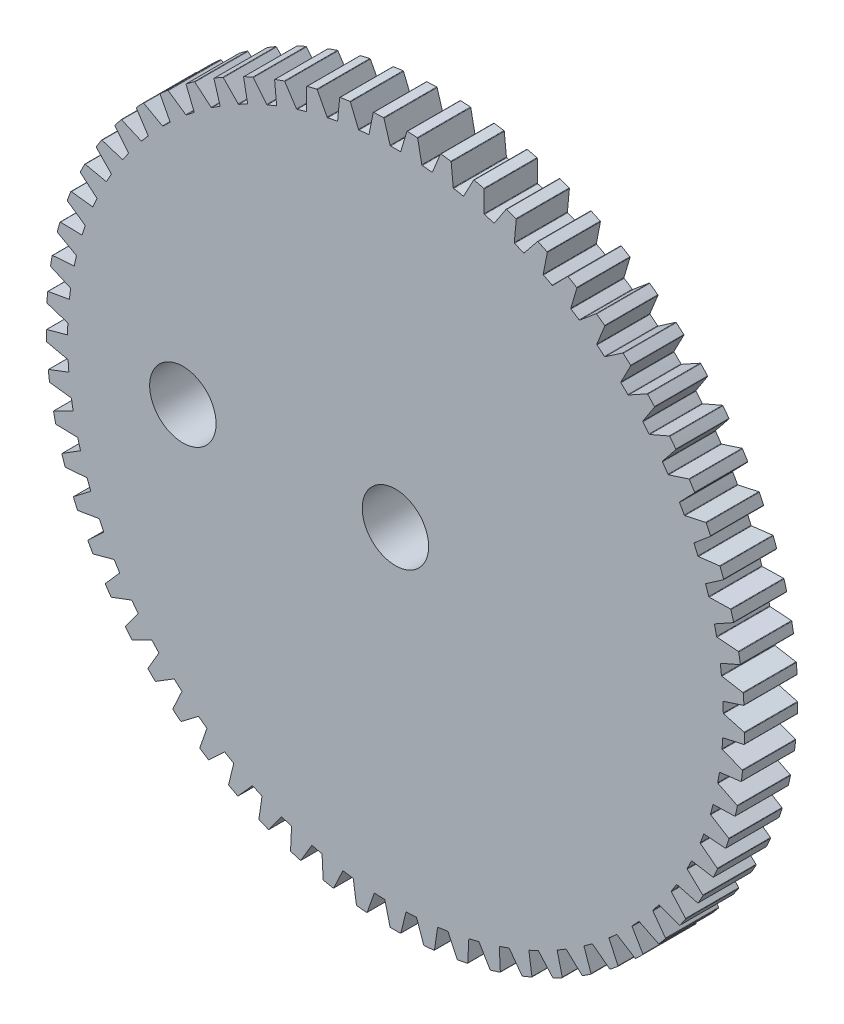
SolidWorks part; units mm, degrees
ref_plane "Front Plane" through (0, 0, 0) normal (0, 0, 1) x (1, 0, 0)
ref_plane "Top Plane" through (0, 0, 0) normal (0, 1, 0) x (1, 0, 0)
ref_plane "Right Plane" through (0, 0, 0) normal (1, 0, 0) x (0, 0, -1)
sketch "Sketch1" plane through (0, 0, 0) normal (0, 0, 1) x (1, 0, 0)
  line L0 (-2.3622, 38.1) -> (-2.3622, -38.1) construction
  circle A0 centre (-19.05, -3.81) radius 16.6878
  dimension "D1" = 33.3756
extrude "Extrude1" add sketch "Sketch1" along normal blind 2.54
sketch "Sketch3" plane through (0, 0, 2.54) normal (0, 0, 1) x (1, 0, 0)
  line L0 (-19.05, -19.4818) -> (-19.05, -20.4978) construction
  line L1 (-19.304, -19.4797) -> (-19.304, -20.4959) construction
  line L2 (-18.796, -19.4797) -> (-18.796, -20.4959) construction
  line L3 (-19.558, -19.4736) -> (-19.558, -20.4978) construction
  line L4 (-18.542, -19.4736) -> (-18.542, -20.4978) construction
  line L9 (-18.7913, -20.4769) -> (-18.5466, -19.4922)
  line L10 (-19.3087, -20.4769) -> (-19.5534, -19.4922)
  line L11 (-15.6135, -19.1004) -> (-22.4865, -19.1004) construction
  line L12 (-20.4011, -20.424) -> (-20.0625, -19.4676)
  line L13 (-20.9161, -20.3741) -> (-21.0646, -19.3704)
  line L14 (-21.9983, -20.2161) -> (-21.569, -19.2967)
  line L15 (-22.5061, -20.1167) -> (-22.557, -19.1033)
  line L16 (-23.5679, -19.8549) -> (-23.0519, -18.9813)
  line L17 (-24.0637, -19.707) -> (-24.0166, -18.6935)
  line L18 (-25.0954, -19.344) -> (-24.4975, -18.5243)
  line L19 (-25.5746, -19.1489) -> (-25.4299, -18.1446)
  line L20 (-26.5664, -18.688) -> (-25.8922, -17.9298)
  line L21 (-27.0246, -18.4476) -> (-26.7836, -17.462)
  line L22 (-27.9672, -17.8931) -> (-27.223, -17.2035)
  line L23 (-28.4001, -17.6096) -> (-28.0651, -16.6518)
  line L24 (-29.2848, -16.9667) -> (-28.4775, -16.3522)
  line L25 (-29.6883, -16.6427) -> (-29.2624, -15.7218)
  line L26 (-30.5069, -15.9175) -> (-29.644, -15.3838)
  line L27 (-30.8771, -15.5561) -> (-30.3644, -14.6805)
  line L28 (-31.6219, -14.7552) -> (-30.7116, -14.3073)
  line L29 (-31.9556, -14.3598) -> (-31.3607, -13.5378)
  line L30 (-32.6196, -13.4908) -> (-31.6702, -13.1328)
  line L31 (-32.9135, -13.0649) -> (-32.2421, -12.3042)
  line L32 (-33.4906, -12.1359) -> (-32.5111, -11.8712)
  line L33 (-33.7421, -11.6837) -> (-33.0004, -10.9914)
  line L34 (-34.2267, -10.7034) -> (-33.2263, -10.5344)
  line L35 (-34.4334, -10.229) -> (-33.6283, -9.6114)
  line L36 (-34.8212, -9.2064) -> (-33.8091, -9.1348)
  line L37 (-34.9811, -8.7143) -> (-34.1202, -8.1773)
  line L38 (-35.2684, -7.6591) -> (-34.2541, -7.6855)
  line L39 (-35.3801, -7.1538) -> (-34.4714, -6.7025)
  line L40 (-35.5642, -6.0758) -> (-34.5572, -6.2)
  line L41 (-35.6265, -5.5621) -> (-34.6785, -5.2006)
  line L42 (-35.7058, -4.4714) -> (-34.7154, -4.6922)
  line L43 (-35.7183, -3.9541) -> (-34.7398, -3.6857)
  line L44 (-35.6918, -2.8608) -> (-34.7275, -3.1761)
  line L45 (-35.6544, -2.3447) -> (-34.6545, -2.172)
  line L46 (-35.5225, -1.259) -> (-34.5931, -1.666)
  line L47 (-35.4354, -0.749) -> (-34.4236, -0.6736)
  line L48 (-35.1994, 0.3189) -> (-34.3136, -0.1759)
  line L49 (-35.0635, 0.8181) -> (-34.0491, 0.7955)
  line L50 (-34.7255, 1.8583) -> (-33.8916, 1.2803)
  line L51 (-34.5421, 2.3421) -> (-33.5346, 2.2216)
  line L52 (-34.1053, 3.3447) -> (-33.331, 2.689)
  line L53 (-33.876, 3.8085) -> (-32.8848, 3.5915)
  line L54 (-33.3445, 4.7643) -> (-32.6371, 4.037)
  line L55 (-33.0715, 5.2039) -> (-32.1059, 4.8922)
  line L56 (-32.4502, 6.1039) -> (-31.8163, 5.3117)
  line L57 (-32.136, 6.5151) -> (-31.2051, 6.1116)
  line L58 (-31.4308, 7.351) -> (-30.8764, 6.5012)
  line L59 (-31.0784, 7.7299) -> (-30.1908, 7.2384)
  line L60 (-30.2958, 8.4938) -> (-29.826, 7.5945)
  line L61 (-29.9085, 8.8369) -> (-29.0724, 8.2621)
  line L62 (-29.0559, 9.5217) -> (-28.675, 8.5813)
  line L63 (-28.6372, 9.8259) -> (-27.8605, 9.173)
  line L64 (-27.7224, 10.4252) -> (-27.4341, 9.4524)
  line L65 (-27.2764, 10.6875) -> (-26.5664, 9.9628)
  line L66 (-26.3081, 11.1957) -> (-26.115, 10.1997)
  line L67 (-25.8388, 11.4138) -> (-25.202, 10.6239)
  line L68 (-24.8259, 11.8262) -> (-24.7299, 10.8161)
  line L69 (-24.3378, 11.9979) -> (-23.7802, 11.1503)
  line L70 (-23.2898, 12.3107) -> (-23.2917, 11.296)
  line L71 (-22.7874, 12.4345) -> (-22.3142, 11.537)
  line L72 (-21.7142, 12.6446) -> (-21.814, 11.6349)
  line L73 (-21.2022, 12.7194) -> (-20.8178, 11.7804)
  line L74 (-20.1136, 12.8249) -> (-20.3104, 11.8296)
  line L75 (-19.5968, 12.8499) -> (-19.3049, 11.8782)
  line L76 (-18.5032, 12.8499) -> (-18.7951, 11.8782)
  line L77 (-17.9864, 12.8249) -> (-17.7896, 11.8296)
  line L78 (-16.8978, 12.7194) -> (-17.2822, 11.7804)
  line L79 (-16.3858, 12.6446) -> (-16.286, 11.6349)
  line L80 (-15.3126, 12.4345) -> (-15.7858, 11.537)
  line L81 (-14.8102, 12.3107) -> (-14.8083, 11.296)
  line L82 (-13.7622, 11.9979) -> (-14.3198, 11.1503)
  line L83 (-13.2741, 11.8262) -> (-13.3701, 10.8161)
  line L84 (-12.2612, 11.4138) -> (-12.898, 10.6239)
  line L85 (-11.7919, 11.1957) -> (-11.985, 10.1997)
  line L86 (-10.8236, 10.6875) -> (-11.5336, 9.9628)
  line L87 (-10.3776, 10.4252) -> (-10.6659, 9.4524)
  line L88 (-9.4628, 9.8259) -> (-10.2395, 9.173)
  line L89 (-9.0441, 9.5217) -> (-9.425, 8.5813)
  line L90 (-8.1915, 8.8369) -> (-9.0276, 8.2621)
  line L91 (-7.8042, 8.4938) -> (-8.274, 7.5945)
  line L92 (-7.0216, 7.7299) -> (-7.9092, 7.2384)
  line L93 (-6.6692, 7.351) -> (-7.2236, 6.5012)
  line L94 (-5.964, 6.5151) -> (-6.8949, 6.1116)
  line L95 (-5.6498, 6.1039) -> (-6.2837, 5.3117)
  line L96 (-5.0285, 5.2039) -> (-5.9941, 4.8922)
  line L97 (-4.7555, 4.7643) -> (-5.4629, 4.037)
  line L98 (-4.224, 3.8085) -> (-5.2152, 3.5915)
  line L99 (-3.9947, 3.3447) -> (-4.769, 2.689)
  line L100 (-3.5579, 2.3421) -> (-4.5654, 2.2216)
  line L101 (-3.3745, 1.8583) -> (-4.2084, 1.2803)
  line L102 (-3.0365, 0.8181) -> (-4.0509, 0.7955)
  line L103 (-2.9006, 0.3189) -> (-3.7864, -0.1759)
  line L104 (-2.6646, -0.749) -> (-3.6764, -0.6736)
  line L105 (-2.5775, -1.259) -> (-3.5069, -1.666)
  line L106 (-2.4456, -2.3447) -> (-3.4455, -2.172)
  line L107 (-2.4082, -2.8608) -> (-3.3725, -3.1761)
  line L108 (-2.3817, -3.9541) -> (-3.3602, -3.6857)
  line L109 (-2.3942, -4.4714) -> (-3.3846, -4.6922)
  line L110 (-2.4735, -5.5621) -> (-3.4215, -5.2006)
  line L111 (-2.5358, -6.0758) -> (-3.5428, -6.2)
  line L112 (-2.7199, -7.1538) -> (-3.6286, -6.7025)
  line L113 (-2.8316, -7.6591) -> (-3.8459, -7.6855)
  line L114 (-3.1189, -8.7143) -> (-3.9798, -8.1773)
  line L115 (-3.2788, -9.2064) -> (-4.2909, -9.1348)
  line L116 (-3.6666, -10.229) -> (-4.4717, -9.6114)
  line L117 (-3.8733, -10.7034) -> (-4.8737, -10.5344)
  line L118 (-4.3579, -11.6837) -> (-5.0996, -10.9914)
  line L119 (-4.6094, -12.1359) -> (-5.5889, -11.8712)
  line L120 (-5.1865, -13.0649) -> (-5.8579, -12.3042)
  line L121 (-5.4804, -13.4908) -> (-6.4298, -13.1328)
  line L122 (-6.1444, -14.3598) -> (-6.7393, -13.5378)
  line L123 (-6.4781, -14.7552) -> (-7.3884, -14.3073)
  line L124 (-7.2229, -15.5561) -> (-7.7356, -14.6805)
  line L125 (-7.5931, -15.9175) -> (-8.456, -15.3838)
  line L126 (-8.4117, -16.6427) -> (-8.8376, -15.7218)
  line L127 (-8.8152, -16.9667) -> (-9.6225, -16.3522)
  line L128 (-9.6999, -17.6096) -> (-10.0349, -16.6518)
  line L129 (-10.1328, -17.8931) -> (-10.877, -17.2035)
  line L130 (-11.0754, -18.4476) -> (-11.3164, -17.462)
  line L131 (-11.5336, -18.688) -> (-12.2078, -17.9298)
  line L132 (-12.5254, -19.1489) -> (-12.6701, -18.1446)
  line L133 (-13.0046, -19.344) -> (-13.6025, -18.5243)
  line L134 (-14.0363, -19.707) -> (-14.0834, -18.6935)
  line L135 (-14.5321, -19.8549) -> (-15.0481, -18.9813)
  line L136 (-15.5939, -20.1167) -> (-15.543, -19.1033)
  line L137 (-16.1017, -20.2161) -> (-16.531, -19.2967)
  line L138 (-17.1839, -20.3741) -> (-17.0354, -19.3704)
  line L139 (-17.6989, -20.424) -> (-18.0375, -19.4676)
  arc A0 (-19.2844, -20.4962) -> (-18.8156, -20.4962) centre (-19.05, -3.81) ccw
  arc A1 (-20.037, -19.4507) -> (-20.0625, -19.4676) centre (-20.0386, -19.476) ccw
  arc A2 (-19.3087, -20.4769) -> (-19.2844, -20.4962) centre (-19.2841, -20.4708) ccw
  arc A3 (-18.7913, -20.4769) -> (-18.8156, -20.4962) centre (-18.8159, -20.4708) cw
  arc A4 (-20.4011, -20.424) -> (-20.4271, -20.4409) centre (-20.425, -20.4156) cw
  arc A5 (-18.5228, -19.4729) -> (-18.5466, -19.4922) centre (-18.522, -19.4983) ccw
  arc A6 (-19.5772, -19.4729) -> (-19.5534, -19.4922) centre (-19.578, -19.4983) cw
  arc A7 (-20.8938, -20.3956) -> (-20.4271, -20.4409) centre (-19.05, -3.81) ccw
  arc A8 (-20.9161, -20.3741) -> (-20.8938, -20.3956) centre (-20.891, -20.3704) ccw
  arc A9 (-21.5423, -19.2823) -> (-21.0864, -19.3489) centre (-19.05, -3.81) ccw
  arc A10 (-21.0864, -19.3489) -> (-21.0646, -19.3704) centre (-21.0897, -19.3741) cw
  arc A11 (-21.5419, -19.2824) -> (-21.569, -19.2967) centre (-21.546, -19.3075) ccw
  arc A12 (-20.0374, -19.4507) -> (-19.5772, -19.4729) centre (-19.05, -3.81) ccw
  arc A13 (-21.9983, -20.2161) -> (-22.0258, -20.2303) centre (-22.0213, -20.2053) cw
  arc A14 (-22.4859, -20.1403) -> (-22.0258, -20.2303) centre (-19.05, -3.81) ccw
  arc A15 (-22.5061, -20.1167) -> (-22.4859, -20.1403) centre (-22.4807, -20.1154) ccw
  arc A16 (-23.024, -18.9696) -> (-22.5766, -19.0798) centre (-19.05, -3.81) ccw
  arc A17 (-22.5766, -19.0798) -> (-22.557, -19.1033) centre (-22.5823, -19.1046) cw
  arc A18 (-23.0236, -18.9697) -> (-23.0519, -18.9813) centre (-23.03, -18.9942) ccw
  arc A19 (-23.5679, -19.8549) -> (-23.5967, -19.8665) centre (-23.5898, -19.842) cw
  arc A20 (-24.046, -19.7324) -> (-23.5967, -19.8665) centre (-19.05, -3.81) ccw
  arc A21 (-24.0637, -19.707) -> (-24.046, -19.7324) centre (-24.0384, -19.7082) ccw
  arc A22 (-24.4686, -18.5153) -> (-24.0339, -18.6682) centre (-19.05, -3.81) ccw
  arc A23 (-24.0339, -18.6682) -> (-24.0166, -18.6935) centre (-24.042, -18.6923) cw
  arc A24 (-24.4682, -18.5154) -> (-24.4975, -18.5243) centre (-24.4769, -18.5392) ccw
  arc A25 (-25.0954, -19.344) -> (-25.1251, -19.3527) centre (-25.1159, -19.329) cw
  arc A26 (-25.5594, -19.1759) -> (-25.1251, -19.3527) centre (-19.05, -3.81) ccw
  arc A27 (-25.5746, -19.1489) -> (-25.5594, -19.1759) centre (-25.5495, -19.1525) ccw
  arc A28 (-25.8625, -17.9236) -> (-25.4447, -18.1178) centre (-19.05, -3.81) ccw
  arc A29 (-25.4447, -18.1178) -> (-25.4299, -18.1446) centre (-25.455, -18.141) cw
  arc A30 (-25.8621, -17.9238) -> (-25.8922, -17.9298) centre (-25.8732, -17.9467) ccw
  arc A31 (-26.5664, -18.688) -> (-26.5969, -18.6938) centre (-26.5854, -18.6711) cw
  arc A32 (-27.012, -18.4759) -> (-26.5969, -18.6938) centre (-19.05, -3.81) ccw
  arc A33 (-27.0246, -18.4476) -> (-27.012, -18.4759) centre (-26.9999, -18.4536) ccw
  arc A34 (-27.1929, -17.2003) -> (-26.7957, -17.4338) centre (-19.05, -3.81) ccw
  arc A35 (-26.7957, -17.4338) -> (-26.7836, -17.462) centre (-26.8083, -17.4559) cw
  arc A36 (-27.1925, -17.2005) -> (-27.223, -17.2035) centre (-27.2057, -17.2222) ccw
  arc A37 (-27.9672, -17.8931) -> (-27.9981, -17.8959) centre (-27.9845, -17.8745) cw
  arc A38 (-28.3903, -17.639) -> (-27.9981, -17.8959) centre (-19.05, -3.81) ccw
  arc A39 (-28.4001, -17.6096) -> (-28.3903, -17.639) centre (-28.3761, -17.618) ccw
  arc A40 (-28.4472, -16.3518) -> (-28.0744, -16.6227) centre (-19.05, -3.81) ccw
  arc A41 (-28.0744, -16.6227) -> (-28.0651, -16.6518) centre (-28.0891, -16.6434) cw
  arc A42 (-28.4469, -16.3521) -> (-28.4775, -16.3522) centre (-28.4621, -16.3724) ccw
  arc A43 (-29.2848, -16.9667) -> (-29.3158, -16.9666) centre (-29.3002, -16.9465) cw
  arc A44 (-29.6814, -16.673) -> (-29.3158, -16.9666) centre (-19.05, -3.81) ccw
  arc A45 (-29.6883, -16.6427) -> (-29.6814, -16.673) centre (-29.6652, -16.6534) ccw
  arc A46 (-29.6138, -15.3863) -> (-29.2689, -15.6919) centre (-19.05, -3.81) ccw
  arc A47 (-29.2689, -15.6919) -> (-29.2624, -15.7218) centre (-29.2855, -15.7111) cw
  arc A48 (-29.6135, -15.3866) -> (-29.644, -15.3838) centre (-29.6306, -15.4054) ccw
  arc A49 (-30.5069, -15.9175) -> (-30.5377, -15.9143) centre (-30.5202, -15.8959) cw
  arc A50 (-30.8732, -15.5868) -> (-30.5377, -15.9143) centre (-19.05, -3.81) ccw
  arc A51 (-30.8771, -15.5561) -> (-30.8732, -15.5868) centre (-30.8552, -15.5689) ccw
  arc A52 (-30.6818, -14.3127) -> (-30.368, -14.6501) centre (-19.05, -3.81) ccw
  arc A53 (-30.368, -14.6501) -> (-30.3644, -14.6805) centre (-30.3863, -14.6677) cw
  arc A54 (-30.6815, -14.313) -> (-30.7116, -14.3073) centre (-30.7003, -14.3301) ccw
  arc A55 (-31.6219, -14.7552) -> (-31.6523, -14.7491) centre (-31.6331, -14.7325) cw
  arc A56 (-31.9547, -14.3908) -> (-31.6523, -14.7491) centre (-19.05, -3.81) ccw
  arc A57 (-31.9556, -14.3598) -> (-31.9547, -14.3908) centre (-31.935, -14.3747) ccw
  arc A58 (-31.6411, -13.1411) -> (-31.3614, -13.5072) centre (-19.05, -3.81) ccw
  arc A59 (-31.3614, -13.5072) -> (-31.3607, -13.5378) centre (-31.3813, -13.5229) cw
  arc A60 (-31.6409, -13.1414) -> (-31.6702, -13.1328) centre (-31.6613, -13.1565) ccw
  arc A61 (-32.6196, -13.4908) -> (-32.6493, -13.4817) centre (-32.6286, -13.467) cw
  arc A62 (-32.9156, -13.0959) -> (-32.6493, -13.4817) centre (-19.05, -3.81) ccw
  arc A63 (-32.9135, -13.0649) -> (-32.9156, -13.0959) centre (-32.8945, -13.0818) ccw
  arc A64 (-32.4829, -11.8823) -> (-32.2398, -12.2737) centre (-19.05, -3.81) ccw
  arc A65 (-32.2398, -12.2737) -> (-32.2421, -12.3042) centre (-32.2612, -12.2874) cw
  arc A66 (-32.4827, -11.8827) -> (-32.5111, -11.8712) centre (-32.5045, -11.8957) ccw
  arc A67 (-33.4906, -12.1359) -> (-33.5192, -12.1241) centre (-33.4972, -12.1114) cw
  arc A68 (-33.7471, -11.7143) -> (-33.5192, -12.1241) centre (-19.05, -3.81) ccw
  arc A69 (-33.7421, -11.6837) -> (-33.7471, -11.7143) centre (-33.7247, -11.7023) ccw
  arc A70 (-33.1993, -10.5481) -> (-32.9951, -10.9612) centre (-19.05, -3.81) ccw
  arc A71 (-32.9951, -10.9612) -> (-33.0004, -10.9914) centre (-33.0177, -10.9728) cw
  arc A72 (-33.1991, -10.5485) -> (-33.2263, -10.5344) centre (-33.2221, -10.5594) ccw
  arc A73 (-34.2267, -10.7034) -> (-34.2541, -10.6888) centre (-34.231, -10.6783) cw
  arc A74 (-34.4414, -10.2589) -> (-34.2541, -10.6888) centre (-19.05, -3.81) ccw
  arc A75 (-34.4334, -10.229) -> (-34.4414, -10.2589) centre (-34.4179, -10.2491) ccw
  arc A76 (-33.7836, -9.1511) -> (-33.6202, -9.5819) centre (-19.05, -3.81) ccw
  arc A77 (-33.6202, -9.5819) -> (-33.6283, -9.6114) centre (-33.6438, -9.5913) cw
  arc A78 (-33.7834, -9.1515) -> (-33.8091, -9.1348) centre (-33.8073, -9.1601) ccw
  arc A79 (-34.8212, -9.2064) -> (-34.847, -9.1893) centre (-34.823, -9.1811) cw
  arc A80 (-34.9919, -8.7434) -> (-34.847, -9.1893) centre (-19.05, -3.81) ccw
  arc A81 (-34.9811, -8.7143) -> (-34.9919, -8.7434) centre (-34.9677, -8.7358) ccw
  arc A82 (-34.2303, -7.7042) -> (-34.1092, -8.1487) centre (-19.05, -3.81) ccw
  arc A83 (-34.1092, -8.1487) -> (-34.1202, -8.1773) centre (-34.1336, -8.1558) cw
  arc A84 (-34.2302, -7.7046) -> (-34.2541, -7.6855) centre (-34.2548, -7.7109) ccw
  arc A85 (-35.2684, -7.6591) -> (-35.2925, -7.6395) centre (-35.2677, -7.6337) cw
  arc A86 (-35.3936, -7.1817) -> (-35.2925, -7.6395) centre (-19.05, -3.81) ccw
  arc A87 (-35.3801, -7.1538) -> (-35.3936, -7.1817) centre (-35.3688, -7.1766) ccw
  arc A88 (-34.5353, -6.2209) -> (-34.4577, -6.6751) centre (-19.05, -3.81) ccw
  arc A89 (-34.4577, -6.6751) -> (-34.4714, -6.7025) centre (-34.4827, -6.6797) cw
  arc A90 (-34.5352, -6.2213) -> (-34.5572, -6.2) centre (-34.5603, -6.2252) ccw
  arc A91 (-35.5642, -6.0758) -> (-35.5862, -6.054) centre (-35.5611, -6.0506) cw
  arc A92 (-35.6427, -5.5886) -> (-35.5862, -6.054) centre (-19.05, -3.81) ccw
  arc A93 (-35.6265, -5.5621) -> (-35.6427, -5.5886) centre (-35.6175, -5.5859) ccw
  arc A94 (-34.6956, -4.7151) -> (-34.6623, -5.1746) centre (-19.05, -3.81) ccw
  arc A95 (-34.6623, -5.1746) -> (-34.6785, -5.2006) centre (-34.6876, -5.1768) cw
  arc A96 (-34.6956, -4.7155) -> (-34.7154, -4.6922) centre (-34.721, -4.717) ccw
  arc A97 (-35.7058, -4.4714) -> (-35.7256, -4.4476) centre (-35.7002, -4.4466) cw
  arc A98 (-35.7369, -3.9788) -> (-35.7256, -4.4476) centre (-19.05, -3.81) ccw
  arc A99 (-35.7183, -3.9541) -> (-35.7369, -3.9788) centre (-35.7115, -3.9786) ccw
  arc A100 (-34.71, -3.2008) -> (-34.7211, -3.6615) centre (-19.05, -3.81) ccw
  arc A101 (-34.7211, -3.6615) -> (-34.7398, -3.6857) centre (-34.7465, -3.6612) cw
  arc A102 (-34.71, -3.2012) -> (-34.7275, -3.1761) centre (-34.7354, -3.2003) ccw
  arc A103 (-35.6918, -2.8608) -> (-35.7093, -2.8351) centre (-35.6839, -2.8366) cw
  arc A104 (-35.6753, -2.3675) -> (-35.7093, -2.8351) centre (-19.05, -3.81) ccw
  arc A105 (-35.6544, -2.3447) -> (-35.6753, -2.3675) centre (-35.65, -2.3697) ccw
  arc A106 (-34.5781, -1.6923) -> (-34.6336, -2.1497) centre (-19.05, -3.81) ccw
  arc A107 (-34.6336, -2.1497) -> (-34.6545, -2.172) centre (-34.6589, -2.147) cw
  arc A108 (-34.5781, -1.6927) -> (-34.5931, -1.666) centre (-34.6033, -1.6892) ccw
  arc A109 (-35.5225, -1.259) -> (-35.5374, -1.2318) centre (-35.5123, -1.2358) cw
  arc A110 (-35.4585, -0.7697) -> (-35.5374, -1.2318) centre (-19.05, -3.81) ccw
  arc A111 (-35.4354, -0.749) -> (-35.4585, -0.7697) centre (-35.4335, -0.7743) ccw
  arc A112 (-34.3012, -0.2035) -> (-34.4006, -0.6534) centre (-19.05, -3.81) ccw
  arc A113 (-34.4006, -0.6534) -> (-34.4236, -0.6736) centre (-34.4255, -0.6483) cw
  arc A114 (-34.3013, -0.2039) -> (-34.3136, -0.1759) centre (-34.326, -0.198) ccw
  arc A115 (-35.1994, 0.3189) -> (-35.2116, 0.3474) centre (-35.187, 0.3411) cw
  arc A116 (-35.0885, 0.7998) -> (-35.2116, 0.3474) centre (-19.05, -3.81) ccw
  arc A117 (-35.0635, 0.8181) -> (-35.0885, 0.7998) centre (-35.0641, 0.7927) ccw
  arc A118 (-33.8819, 1.2516) -> (-34.0243, 0.8134) centre (-19.05, -3.81) ccw
  arc A119 (-34.0243, 0.8134) -> (-34.0491, 0.7955) centre (-34.0486, 0.8209) cw
  arc A120 (-33.882, 1.2512) -> (-33.8916, 1.2803) centre (-33.9061, 1.2594) ccw
  arc A121 (-34.7255, 1.8583) -> (-34.735, 1.8878) centre (-34.7111, 1.8791) cw
  arc A122 (-34.5687, 2.3262) -> (-34.735, 1.8878) centre (-19.05, -3.81) ccw
  arc A123 (-34.5421, 2.3421) -> (-34.5687, 2.3262) centre (-34.5451, 2.3168) ccw
  arc A124 (-33.3241, 2.6595) -> (-33.5082, 2.2371) centre (-19.05, -3.81) ccw
  arc A125 (-33.5082, 2.2371) -> (-33.5346, 2.2216) centre (-33.5316, 2.2469) cw
  arc A126 (-33.3243, 2.6591) -> (-33.331, 2.689) centre (-33.3474, 2.6696) ccw
  arc A127 (-34.1053, 3.3447) -> (-34.1118, 3.375) centre (-34.0889, 3.3641) cw
  arc A128 (-33.904, 3.7953) -> (-34.1118, 3.375) centre (-19.05, -3.81) ccw
  arc A129 (-33.876, 3.8085) -> (-33.904, 3.7953) centre (-33.8814, 3.7837) ccw
  arc A130 (-32.6331, 4.0069) -> (-32.857, 3.6042) centre (-19.05, -3.81) ccw
  arc A131 (-32.857, 3.6042) -> (-32.8848, 3.5915) centre (-32.8794, 3.6163) cw
  arc A132 (-32.6333, 4.0066) -> (-32.6371, 4.037) centre (-32.6553, 4.0192) ccw
  arc A133 (-33.3445, 4.7643) -> (-33.348, 4.7952) centre (-33.3263, 4.7821) cw
  arc A134 (-33.1007, 5.1934) -> (-33.348, 4.7952) centre (-19.05, -3.81) ccw
  arc A135 (-33.0715, 5.2039) -> (-33.1007, 5.1934) centre (-33.0793, 5.1797) ccw
  arc A136 (-31.8152, 5.2814) -> (-32.077, 4.9022) centre (-19.05, -3.81) ccw
  arc A137 (-32.077, 4.9022) -> (-32.1059, 4.8922) centre (-32.0981, 4.9163) cw
  arc A138 (-31.8155, 5.2811) -> (-31.8163, 5.3117) centre (-31.8362, 5.2958) ccw
  arc A139 (-32.4502, 6.1039) -> (-32.4508, 6.1349) centre (-32.4304, 6.1198) cw
  arc A140 (-32.1661, 6.5075) -> (-32.4508, 6.1349) centre (-19.05, -3.81) ccw
  arc A141 (-32.136, 6.5151) -> (-32.1661, 6.5075) centre (-32.1461, 6.4918) ccw
  arc A142 (-30.8782, 6.471) -> (-31.1753, 6.1188) centre (-19.05, -3.81) ccw
  arc A143 (-31.1753, 6.1188) -> (-31.2051, 6.1116) centre (-31.195, 6.1349) cw
  arc A144 (-30.8785, 6.4707) -> (-30.8764, 6.5012) centre (-30.8977, 6.4873) ccw
  arc A145 (-31.4308, 7.351) -> (-31.4284, 7.3819) centre (-31.4096, 7.3648) cw
  arc A146 (-31.1091, 7.7252) -> (-31.4284, 7.3819) centre (-19.05, -3.81) ccw
  arc A147 (-31.0784, 7.7299) -> (-31.1091, 7.7252) centre (-31.0907, 7.7076) ccw
  arc A148 (-29.8307, 7.5646) -> (-30.1605, 7.2427) centre (-19.05, -3.81) ccw
  arc A149 (-30.1605, 7.2427) -> (-30.1908, 7.2384) centre (-30.1785, 7.2606) cw
  arc A150 (-29.831, 7.5643) -> (-29.826, 7.5945) centre (-29.8485, 7.5827) ccw
  arc A151 (-30.2958, 8.4938) -> (-30.2904, 8.5243) centre (-30.2733, 8.5055) cw
  arc A152 (-29.9395, 8.8352) -> (-30.2904, 8.5243) centre (-19.05, -3.81) ccw
  arc A153 (-29.9085, 8.8369) -> (-29.9395, 8.8352) centre (-29.9229, 8.816) ccw
  arc A154 (-28.6826, 8.552) -> (-29.0419, 8.2634) centre (-19.05, -3.81) ccw
  arc A155 (-29.0419, 8.2634) -> (-29.0724, 8.2621) centre (-29.058, 8.283) cw
  arc A156 (-28.6829, 8.5517) -> (-28.675, 8.5813) centre (-28.6985, 8.5718) ccw
  arc A157 (-29.0559, 9.5217) -> (-29.0475, 9.5516) centre (-29.0323, 9.5313) cw
  arc A158 (-28.6682, 9.8272) -> (-29.0475, 9.5516) centre (-19.05, -3.81) ccw
  arc A159 (-28.6372, 9.8259) -> (-28.6682, 9.8272) centre (-28.6536, 9.8064) ccw
  arc A160 (-27.4445, 9.4239) -> (-27.83, 9.1714) centre (-19.05, -3.81) ccw
  arc A161 (-27.83, 9.1714) -> (-27.8605, 9.173) centre (-27.8442, 9.1925) cw
  arc A162 (-27.4449, 9.4237) -> (-27.4341, 9.4524) centre (-27.4585, 9.4452) ccw
  arc A163 (-27.7224, 10.4252) -> (-27.7113, 10.4541) centre (-27.6981, 10.4324) cw
  arc A164 (-27.3071, 10.6918) -> (-27.7113, 10.4541) centre (-19.05, -3.81) ccw
  arc A165 (-27.2764, 10.6875) -> (-27.3071, 10.6918) centre (-27.2946, 10.6697) ccw
  arc A166 (-26.1281, 10.1724) -> (-26.5361, 9.9582) centre (-19.05, -3.81) ccw
  arc A167 (-26.5361, 9.9582) -> (-26.5664, 9.9628) centre (-26.5482, 9.9805) cw
  arc A168 (-26.1285, 10.1722) -> (-26.115, 10.1997) centre (-26.1399, 10.1948) ccw
  arc A169 (-26.3081, 11.1957) -> (-26.2942, 11.2235) centre (-26.2831, 11.2006) cw
  arc A170 (-25.869, 11.421) -> (-26.2942, 11.2235) centre (-19.05, -3.81) ccw
  arc A171 (-25.8388, 11.4138) -> (-25.869, 11.421) centre (-25.8586, 11.3978) ccw
  arc A172 (-24.7455, 10.7902) -> (-25.1723, 10.6165) centre (-19.05, -3.81) ccw
  arc A173 (-25.1723, 10.6165) -> (-25.202, 10.6239) centre (-25.1822, 10.6398) cw
  arc A174 (-24.7459, 10.7901) -> (-24.7299, 10.8161) centre (-24.7552, 10.8137) ccw
  arc A175 (-24.8259, 11.8262) -> (-24.8094, 11.8524) centre (-24.8006, 11.8286) cw
  arc A176 (-24.3671, 12.0081) -> (-24.8094, 11.8524) centre (-19.05, -3.81) ccw
  arc A177 (-24.3378, 11.9979) -> (-24.3671, 12.0081) centre (-24.359, 11.984) ccw
  arc A178 (-23.3098, 11.2717) -> (-23.7514, 11.14) centre (-19.05, -3.81) ccw
  arc A179 (-23.7514, 11.14) -> (-23.7802, 11.1503) centre (-23.759, 11.1642) cw
  arc A180 (-23.3102, 11.2716) -> (-23.2917, 11.296) centre (-23.3171, 11.2961) ccw
  arc A181 (-23.2898, 12.3107) -> (-23.2709, 12.3352) centre (-23.2644, 12.3106) cw
  arc A182 (-22.8156, 12.4474) -> (-23.2709, 12.3352) centre (-19.05, -3.81) ccw
  arc A183 (-22.7874, 12.4345) -> (-22.8156, 12.4474) centre (-22.8099, 12.4226) ccw
  arc A184 (-21.8343, 11.6125) -> (-22.2865, 11.524) centre (-19.05, -3.81) ccw
  arc A185 (-22.2865, 11.524) -> (-22.3142, 11.537) centre (-22.2918, 11.5488) cw
  arc A186 (-21.8348, 11.6124) -> (-21.814, 11.6349) centre (-21.8393, 11.6374) ccw
  arc A187 (-21.7142, 12.6446) -> (-21.6929, 12.6672) centre (-21.6889, 12.6421) cw
  arc A188 (-21.229, 12.7349) -> (-21.6929, 12.6672) centre (-19.05, -3.81) ccw
  arc A189 (-21.2022, 12.7194) -> (-21.229, 12.7349) centre (-21.2257, 12.7097) ccw
  arc A190 (-20.3329, 11.8092) -> (-20.7915, 11.7647) centre (-19.05, -3.81) ccw
  arc A191 (-20.7915, 11.7647) -> (-20.8178, 11.7804) centre (-20.7943, 11.79) cw
  arc A192 (-20.3333, 11.8092) -> (-20.3104, 11.8296) centre (-20.3354, 11.8345) ccw
  arc A193 (-20.1136, 12.8249) -> (-20.0903, 12.8453) centre (-20.0887, 12.82) cw
  arc A194 (-19.622, 12.868) -> (-20.0903, 12.8453) centre (-19.05, -3.81) ccw
  arc A195 (-19.5968, 12.8499) -> (-19.622, 12.868) centre (-19.6211, 12.8426) ccw
  arc A196 (-18.8194, 11.8601) -> (-19.2802, 11.8601) centre (-19.05, -3.81) ccw
  arc A197 (-19.2802, 11.8601) -> (-19.3049, 11.8782) centre (-19.2805, 11.8855) cw
  arc A198 (-18.8198, 11.8601) -> (-18.7951, 11.8782) centre (-18.8195, 11.8855) ccw
  arc A199 (-18.5032, 12.8499) -> (-18.478, 12.868) centre (-18.4789, 12.8426) cw
  arc A200 (-18.0097, 12.8453) -> (-18.478, 12.868) centre (-19.05, -3.81) ccw
  arc A201 (-17.9864, 12.8249) -> (-18.0097, 12.8453) centre (-18.0113, 12.82) ccw
  arc A202 (-17.3081, 11.7647) -> (-17.7667, 11.8092) centre (-19.05, -3.81) ccw
  arc A203 (-17.7667, 11.8092) -> (-17.7896, 11.8296) centre (-17.7646, 11.8345) cw
  arc A204 (-17.3085, 11.7647) -> (-17.2822, 11.7804) centre (-17.3057, 11.79) ccw
  arc A205 (-16.8978, 12.7194) -> (-16.871, 12.7349) centre (-16.8743, 12.7097) cw
  arc A206 (-16.4071, 12.6672) -> (-16.871, 12.7349) centre (-19.05, -3.81) ccw
  arc A207 (-16.3858, 12.6446) -> (-16.4071, 12.6672) centre (-16.4111, 12.6421) ccw
  arc A208 (-15.8131, 11.5239) -> (-16.2652, 11.6124) centre (-19.05, -3.81) ccw
  arc A209 (-16.2652, 11.6124) -> (-16.286, 11.6349) centre (-16.2607, 11.6374) cw
  arc A210 (-15.8135, 11.524) -> (-15.7858, 11.537) centre (-15.8082, 11.5488) ccw
  arc A211 (-15.3126, 12.4345) -> (-15.2844, 12.4474) centre (-15.2901, 12.4226) cw
  arc A212 (-14.8291, 12.3352) -> (-15.2844, 12.4474) centre (-19.05, -3.81) ccw
  arc A213 (-14.8102, 12.3107) -> (-14.8291, 12.3352) centre (-14.8356, 12.3106) ccw
  arc A214 (-14.3482, 11.1399) -> (-14.7898, 11.2716) centre (-19.05, -3.81) ccw
  arc A215 (-14.7898, 11.2716) -> (-14.8083, 11.296) centre (-14.7829, 11.2961) cw
  arc A216 (-14.3486, 11.14) -> (-14.3198, 11.1503) centre (-14.341, 11.1642) ccw
  arc A217 (-13.7622, 11.9979) -> (-13.7329, 12.0081) centre (-13.741, 11.984) cw
  arc A218 (-13.2906, 11.8524) -> (-13.7329, 12.0081) centre (-19.05, -3.81) ccw
  arc A219 (-13.2741, 11.8262) -> (-13.2906, 11.8524) centre (-13.2994, 11.8286) ccw
  arc A220 (-12.9273, 10.6163) -> (-13.3541, 10.7901) centre (-19.05, -3.81) ccw
  arc A221 (-13.3541, 10.7901) -> (-13.3701, 10.8161) centre (-13.3448, 10.8137) cw
  arc A222 (-12.9277, 10.6165) -> (-12.898, 10.6239) centre (-12.9178, 10.6398) ccw
  arc A223 (-12.2612, 11.4138) -> (-12.231, 11.421) centre (-12.2414, 11.3978) cw
  arc A224 (-11.8058, 11.2235) -> (-12.231, 11.421) centre (-19.05, -3.81) ccw
  arc A225 (-11.7919, 11.1957) -> (-11.8058, 11.2235) centre (-11.8169, 11.2006) ccw
  arc A226 (-11.5636, 9.958) -> (-11.9715, 10.1722) centre (-19.05, -3.81) ccw
  arc A227 (-11.9715, 10.1722) -> (-11.985, 10.1997) centre (-11.9601, 10.1948) cw
  arc A228 (-11.5639, 9.9582) -> (-11.5336, 9.9628) centre (-11.5518, 9.9805) ccw
  arc A229 (-10.8236, 10.6875) -> (-10.7929, 10.6918) centre (-10.8054, 10.6697) cw
  arc A230 (-10.3887, 10.4541) -> (-10.7929, 10.6918) centre (-19.05, -3.81) ccw
  arc A231 (-10.3776, 10.4252) -> (-10.3887, 10.4541) centre (-10.4019, 10.4324) ccw
  arc A232 (-10.2697, 9.1712) -> (-10.6551, 9.4237) centre (-19.05, -3.81) ccw
  arc A233 (-10.6551, 9.4237) -> (-10.6659, 9.4524) centre (-10.6415, 9.4452) cw
  arc A234 (-10.27, 9.1714) -> (-10.2395, 9.173) centre (-10.2558, 9.1925) ccw
  arc A235 (-9.4628, 9.8259) -> (-9.4318, 9.8272) centre (-9.4464, 9.8064) cw
  arc A236 (-9.0525, 9.5516) -> (-9.4318, 9.8272) centre (-19.05, -3.81) ccw
  arc A237 (-9.0441, 9.5217) -> (-9.0525, 9.5516) centre (-9.0677, 9.5313) ccw
  arc A238 (-9.0578, 8.2632) -> (-9.4171, 8.5517) centre (-19.05, -3.81) ccw
  arc A239 (-9.4171, 8.5517) -> (-9.425, 8.5813) centre (-9.4015, 8.5718) cw
  arc A240 (-9.0581, 8.2634) -> (-9.0276, 8.2621) centre (-9.042, 8.283) ccw
  arc A241 (-8.1915, 8.8369) -> (-8.1605, 8.8352) centre (-8.1771, 8.816) cw
  arc A242 (-7.8096, 8.5243) -> (-8.1605, 8.8352) centre (-19.05, -3.81) ccw
  arc A243 (-7.8042, 8.4938) -> (-7.8096, 8.5243) centre (-7.8267, 8.5055) ccw
  arc A244 (-7.9392, 7.2424) -> (-8.269, 7.5643) centre (-19.05, -3.81) ccw
  arc A245 (-8.269, 7.5643) -> (-8.274, 7.5945) centre (-8.2515, 7.5827) cw
  arc A246 (-7.9395, 7.2427) -> (-7.9092, 7.2384) centre (-7.9215, 7.2606) ccw
  arc A247 (-7.0216, 7.7299) -> (-6.9909, 7.7252) centre (-7.0093, 7.7076) cw
  arc A248 (-6.6716, 7.3819) -> (-6.9909, 7.7252) centre (-19.05, -3.81) ccw
  arc A249 (-6.6692, 7.351) -> (-6.6716, 7.3819) centre (-6.6904, 7.3648) ccw
  arc A250 (-6.9244, 6.1185) -> (-7.2215, 6.4707) centre (-19.05, -3.81) ccw
  arc A251 (-7.2215, 6.4707) -> (-7.2236, 6.5012) centre (-7.2023, 6.4873) cw
  arc A252 (-6.9247, 6.1188) -> (-6.8949, 6.1116) centre (-6.905, 6.1349) ccw
  arc A253 (-5.964, 6.5151) -> (-5.9339, 6.5075) centre (-5.9539, 6.4918) cw
  arc A254 (-5.6492, 6.1349) -> (-5.9339, 6.5075) centre (-19.05, -3.81) ccw
  arc A255 (-5.6498, 6.1039) -> (-5.6492, 6.1349) centre (-5.6696, 6.1198) ccw
  arc A256 (-6.0228, 4.9019) -> (-6.2845, 5.2811) centre (-19.05, -3.81) ccw
  arc A257 (-6.2845, 5.2811) -> (-6.2837, 5.3117) centre (-6.2638, 5.2958) cw
  arc A258 (-6.023, 4.9022) -> (-5.9941, 4.8922) centre (-6.0019, 4.9163) ccw
  arc A259 (-5.0285, 5.2039) -> (-4.9993, 5.1934) centre (-5.0207, 5.1797) cw
  arc A260 (-4.752, 4.7952) -> (-4.9993, 5.1934) centre (-19.05, -3.81) ccw
  arc A261 (-4.7555, 4.7643) -> (-4.752, 4.7952) centre (-4.7737, 4.7821) ccw
  arc A262 (-5.2428, 3.6039) -> (-5.4667, 4.0066) centre (-19.05, -3.81) ccw
  arc A263 (-5.4667, 4.0066) -> (-5.4629, 4.037) centre (-5.4447, 4.0192) cw
  arc A264 (-5.243, 3.6042) -> (-5.2152, 3.5915) centre (-5.2206, 3.6163) ccw
  arc A265 (-4.224, 3.8085) -> (-4.196, 3.7953) centre (-4.2186, 3.7837) cw
  arc A266 (-3.9882, 3.375) -> (-4.196, 3.7953) centre (-19.05, -3.81) ccw
  arc A267 (-3.9947, 3.3447) -> (-3.9882, 3.375) centre (-4.0111, 3.3641) ccw
  arc A268 (-4.5917, 2.2367) -> (-4.7757, 2.6591) centre (-19.05, -3.81) ccw
  arc A269 (-4.7757, 2.6591) -> (-4.769, 2.689) centre (-4.7526, 2.6696) cw
  arc A270 (-4.5918, 2.2371) -> (-4.5654, 2.2216) centre (-4.5684, 2.2469) ccw
  arc A271 (-3.5579, 2.3421) -> (-3.5313, 2.3262) centre (-3.5549, 2.3168) cw
  arc A272 (-3.365, 1.8878) -> (-3.5313, 2.3262) centre (-19.05, -3.81) ccw
  arc A273 (-3.3745, 1.8583) -> (-3.365, 1.8878) centre (-3.3889, 1.8791) ccw
  arc A274 (-4.0756, 0.813) -> (-4.218, 1.2512) centre (-19.05, -3.81) ccw
  arc A275 (-4.218, 1.2512) -> (-4.2084, 1.2803) centre (-4.1939, 1.2594) cw
  arc A276 (-4.0757, 0.8134) -> (-4.0509, 0.7955) centre (-4.0514, 0.8209) ccw
  arc A277 (-3.0365, 0.8181) -> (-3.0115, 0.7998) centre (-3.0359, 0.7927) cw
  arc A278 (-2.8884, 0.3474) -> (-3.0115, 0.7998) centre (-19.05, -3.81) ccw
  arc A279 (-2.9006, 0.3189) -> (-2.8884, 0.3474) centre (-2.913, 0.3411) ccw
  arc A280 (-3.6993, -0.6538) -> (-3.7987, -0.2039) centre (-19.05, -3.81) ccw
  arc A281 (-3.7987, -0.2039) -> (-3.7864, -0.1759) centre (-3.774, -0.198) cw
  arc A282 (-3.6994, -0.6534) -> (-3.6764, -0.6736) centre (-3.6745, -0.6483) ccw
  arc A283 (-2.6646, -0.749) -> (-2.6415, -0.7697) centre (-2.6665, -0.7743) cw
  arc A284 (-2.5626, -1.2318) -> (-2.6415, -0.7697) centre (-19.05, -3.81) ccw
  arc A285 (-2.5775, -1.259) -> (-2.5626, -1.2318) centre (-2.5877, -1.2358) ccw
  arc A286 (-3.4664, -2.1501) -> (-3.5219, -1.6927) centre (-19.05, -3.81) ccw
  arc A287 (-3.5219, -1.6927) -> (-3.5069, -1.666) centre (-3.4967, -1.6892) cw
  arc A288 (-3.4664, -2.1497) -> (-3.4455, -2.172) centre (-3.4411, -2.147) ccw
  arc A289 (-2.4456, -2.3447) -> (-2.4247, -2.3675) centre (-2.45, -2.3697) cw
  arc A290 (-2.3907, -2.8351) -> (-2.4247, -2.3675) centre (-19.05, -3.81) ccw
  arc A291 (-2.4082, -2.8608) -> (-2.3907, -2.8351) centre (-2.4161, -2.8366) ccw
  arc A292 (-3.3789, -3.6619) -> (-3.39, -3.2012) centre (-19.05, -3.81) ccw
  arc A293 (-3.39, -3.2012) -> (-3.3725, -3.1761) centre (-3.3646, -3.2003) cw
  arc A294 (-3.3789, -3.6615) -> (-3.3602, -3.6857) centre (-3.3535, -3.6612) ccw
  arc A295 (-2.3817, -3.9541) -> (-2.3631, -3.9788) centre (-2.3885, -3.9786) cw
  arc A296 (-2.3744, -4.4476) -> (-2.3631, -3.9788) centre (-19.05, -3.81) ccw
  arc A297 (-2.3942, -4.4714) -> (-2.3744, -4.4476) centre (-2.3998, -4.4466) ccw
  arc A298 (-3.4378, -5.1751) -> (-3.4044, -4.7155) centre (-19.05, -3.81) ccw
  arc A299 (-3.4044, -4.7155) -> (-3.3846, -4.6922) centre (-3.379, -4.717) cw
  arc A300 (-3.4377, -5.1746) -> (-3.4215, -5.2006) centre (-3.4124, -5.1768) ccw
  arc A301 (-2.4735, -5.5621) -> (-2.4573, -5.5886) centre (-2.4825, -5.5859) cw
  arc A302 (-2.5138, -6.054) -> (-2.4573, -5.5886) centre (-19.05, -3.81) ccw
  arc A303 (-2.5358, -6.0758) -> (-2.5138, -6.054) centre (-2.5389, -6.0506) ccw
  arc A304 (-3.6424, -6.6755) -> (-3.5648, -6.2213) centre (-19.05, -3.81) ccw
  arc A305 (-3.5648, -6.2213) -> (-3.5428, -6.2) centre (-3.5397, -6.2252) cw
  arc A306 (-3.6423, -6.6751) -> (-3.6286, -6.7025) centre (-3.6173, -6.6797) ccw
  arc A307 (-2.7199, -7.1538) -> (-2.7064, -7.1817) centre (-2.7312, -7.1766) cw
  arc A308 (-2.8075, -7.6395) -> (-2.7064, -7.1817) centre (-19.05, -3.81) ccw
  arc A309 (-2.8316, -7.6591) -> (-2.8075, -7.6395) centre (-2.8323, -7.6337) ccw
  arc A310 (-3.9909, -8.1491) -> (-3.8698, -7.7046) centre (-19.05, -3.81) ccw
  arc A311 (-3.8698, -7.7046) -> (-3.8459, -7.6855) centre (-3.8452, -7.7109) cw
  arc A312 (-3.9908, -8.1487) -> (-3.9798, -8.1773) centre (-3.9664, -8.1558) ccw
  arc A313 (-3.1189, -8.7143) -> (-3.1081, -8.7434) centre (-3.1323, -8.7358) cw
  arc A314 (-3.253, -9.1893) -> (-3.1081, -8.7434) centre (-19.05, -3.81) ccw
  arc A315 (-3.2788, -9.2064) -> (-3.253, -9.1893) centre (-3.277, -9.1811) ccw
  arc A316 (-4.48, -9.5823) -> (-4.3166, -9.1515) centre (-19.05, -3.81) ccw
  arc A317 (-4.3166, -9.1515) -> (-4.2909, -9.1348) centre (-4.2927, -9.1601) cw
  arc A318 (-4.4798, -9.5819) -> (-4.4717, -9.6114) centre (-4.4562, -9.5913) ccw
  arc A319 (-3.6666, -10.229) -> (-3.6586, -10.2589) centre (-3.6821, -10.2491) cw
  arc A320 (-3.8459, -10.6888) -> (-3.6586, -10.2589) centre (-19.05, -3.81) ccw
  arc A321 (-3.8733, -10.7034) -> (-3.8459, -10.6888) centre (-3.869, -10.6783) ccw
  arc A322 (-5.1051, -10.9616) -> (-4.9009, -10.5485) centre (-19.05, -3.81) ccw
  arc A323 (-4.9009, -10.5485) -> (-4.8737, -10.5344) centre (-4.8779, -10.5594) cw
  arc A324 (-5.1049, -10.9612) -> (-5.0996, -10.9914) centre (-5.0823, -10.9728) ccw
  arc A325 (-4.3579, -11.6837) -> (-4.3529, -11.7143) centre (-4.3753, -11.7023) cw
  arc A326 (-4.5808, -12.1241) -> (-4.3529, -11.7143) centre (-19.05, -3.81) ccw
  arc A327 (-4.6094, -12.1359) -> (-4.5808, -12.1241) centre (-4.6028, -12.1114) ccw
  arc A328 (-5.8604, -12.2741) -> (-5.6173, -11.8827) centre (-19.05, -3.81) ccw
  arc A329 (-5.6173, -11.8827) -> (-5.5889, -11.8712) centre (-5.5955, -11.8957) cw
  arc A330 (-5.8602, -12.2737) -> (-5.8579, -12.3042) centre (-5.8388, -12.2874) ccw
  arc A331 (-5.1865, -13.0649) -> (-5.1844, -13.0959) centre (-5.2055, -13.0818) cw
  arc A332 (-5.4507, -13.4817) -> (-5.1844, -13.0959) centre (-19.05, -3.81) ccw
  arc A333 (-5.4804, -13.4908) -> (-5.4507, -13.4817) centre (-5.4714, -13.467) ccw
  arc A334 (-6.7389, -13.5075) -> (-6.4591, -13.1414) centre (-19.05, -3.81) ccw
  arc A335 (-6.4591, -13.1414) -> (-6.4298, -13.1328) centre (-6.4387, -13.1565) cw
  arc A336 (-6.7386, -13.5072) -> (-6.7393, -13.5378) centre (-6.7187, -13.5229) ccw
  arc A337 (-6.1444, -14.3598) -> (-6.1453, -14.3908) centre (-6.165, -14.3747) cw
  arc A338 (-6.4477, -14.7491) -> (-6.1453, -14.3908) centre (-19.05, -3.81) ccw
  arc A339 (-6.4781, -14.7552) -> (-6.4477, -14.7491) centre (-6.4669, -14.7325) ccw
  arc A340 (-7.7323, -14.6504) -> (-7.4185, -14.313) centre (-19.05, -3.81) ccw
  arc A341 (-7.4185, -14.313) -> (-7.3884, -14.3073) centre (-7.3997, -14.3301) cw
  arc A342 (-7.732, -14.6501) -> (-7.7356, -14.6805) centre (-7.7137, -14.6677) ccw
  arc A343 (-7.2229, -15.5561) -> (-7.2268, -15.5868) centre (-7.2448, -15.5689) cw
  arc A344 (-7.5623, -15.9143) -> (-7.2268, -15.5868) centre (-19.05, -3.81) ccw
  arc A345 (-7.5931, -15.9175) -> (-7.5623, -15.9143) centre (-7.5798, -15.8959) ccw
  arc A346 (-8.8314, -15.6922) -> (-8.4865, -15.3866) centre (-19.05, -3.81) ccw
  arc A347 (-8.4865, -15.3866) -> (-8.456, -15.3838) centre (-8.4694, -15.4054) cw
  arc A348 (-8.8311, -15.6919) -> (-8.8376, -15.7218) centre (-8.8145, -15.7111) ccw
  arc A349 (-8.4117, -16.6427) -> (-8.4186, -16.673) centre (-8.4348, -16.6534) cw
  arc A350 (-8.7842, -16.9666) -> (-8.4186, -16.673) centre (-19.05, -3.81) ccw
  arc A351 (-8.8152, -16.9667) -> (-8.7842, -16.9666) centre (-8.7998, -16.9465) ccw
  arc A352 (-10.0259, -16.6229) -> (-9.6531, -16.3521) centre (-19.05, -3.81) ccw
  arc A353 (-9.6531, -16.3521) -> (-9.6225, -16.3522) centre (-9.6379, -16.3724) cw
  arc A354 (-10.0256, -16.6227) -> (-10.0349, -16.6518) centre (-10.0109, -16.6434) ccw
  arc A355 (-9.6999, -17.6096) -> (-9.7097, -17.639) centre (-9.7239, -17.618) cw
  arc A356 (-10.1019, -17.8959) -> (-9.7097, -17.639) centre (-19.05, -3.81) ccw
  arc A357 (-10.1328, -17.8931) -> (-10.1019, -17.8959) centre (-10.1155, -17.8745) ccw
  arc A358 (-11.3047, -17.4341) -> (-10.9075, -17.2005) centre (-19.05, -3.81) ccw
  arc A359 (-10.9075, -17.2005) -> (-10.877, -17.2035) centre (-10.8943, -17.2222) cw
  arc A360 (-11.3043, -17.4338) -> (-11.3164, -17.462) centre (-11.2917, -17.4559) ccw
  arc A361 (-11.0754, -18.4476) -> (-11.088, -18.4759) centre (-11.1001, -18.4536) cw
  arc A362 (-11.5031, -18.6938) -> (-11.088, -18.4759) centre (-19.05, -3.81) ccw
  arc A363 (-11.5336, -18.688) -> (-11.5031, -18.6938) centre (-11.5146, -18.6711) ccw
  arc A364 (-12.6557, -18.118) -> (-12.2379, -17.9238) centre (-19.05, -3.81) ccw
  arc A365 (-12.2379, -17.9238) -> (-12.2078, -17.9298) centre (-12.2268, -17.9467) cw
  arc A366 (-12.6553, -18.1178) -> (-12.6701, -18.1446) centre (-12.645, -18.141) ccw
  arc A367 (-12.5254, -19.1489) -> (-12.5406, -19.1759) centre (-12.5505, -19.1525) cw
  arc A368 (-12.9749, -19.3527) -> (-12.5406, -19.1759) centre (-19.05, -3.81) ccw
  arc A369 (-13.0046, -19.344) -> (-12.9749, -19.3527) centre (-12.9841, -19.329) ccw
  arc A370 (-14.0665, -18.6683) -> (-13.6318, -18.5154) centre (-19.05, -3.81) ccw
  arc A371 (-13.6318, -18.5154) -> (-13.6025, -18.5243) centre (-13.6231, -18.5392) cw
  arc A372 (-14.0661, -18.6682) -> (-14.0834, -18.6935) centre (-14.058, -18.6923) ccw
  arc A373 (-14.0363, -19.707) -> (-14.054, -19.7324) centre (-14.0616, -19.7082) cw
  arc A374 (-14.5033, -19.8665) -> (-14.054, -19.7324) centre (-19.05, -3.81) ccw
  arc A375 (-14.5321, -19.8549) -> (-14.5033, -19.8665) centre (-14.5102, -19.842) ccw
  arc A376 (-15.5238, -19.0799) -> (-15.0764, -18.9697) centre (-19.05, -3.81) ccw
  arc A377 (-15.0764, -18.9697) -> (-15.0481, -18.9813) centre (-15.07, -18.9942) cw
  arc A378 (-15.5234, -19.0798) -> (-15.543, -19.1033) centre (-15.5177, -19.1046) ccw
  arc A379 (-15.5939, -20.1167) -> (-15.6141, -20.1403) centre (-15.6193, -20.1154) cw
  arc A380 (-16.0742, -20.2303) -> (-15.6141, -20.1403) centre (-19.05, -3.81) ccw
  arc A381 (-16.1017, -20.2161) -> (-16.0742, -20.2303) centre (-16.0787, -20.2053) ccw
  arc A382 (-17.014, -19.349) -> (-16.5581, -19.2824) centre (-19.05, -3.81) ccw
  arc A383 (-16.5581, -19.2824) -> (-16.531, -19.2967) centre (-16.554, -19.3075) cw
  arc A384 (-17.0136, -19.3489) -> (-17.0354, -19.3704) centre (-17.0103, -19.3741) ccw
  arc A385 (-17.1839, -20.3741) -> (-17.2062, -20.3956) centre (-17.209, -20.3704) cw
  arc A386 (-17.6729, -20.4409) -> (-17.2062, -20.3956) centre (-19.05, -3.81) ccw
  arc A387 (-17.6989, -20.424) -> (-17.6729, -20.4409) centre (-17.675, -20.4156) ccw
  arc A388 (-18.5233, -19.4729) -> (-18.063, -19.4507) centre (-19.05, -3.81) ccw
  arc A389 (-18.063, -19.4507) -> (-18.0375, -19.4676) centre (-18.0614, -19.476) cw
  circle A391 centre (-19.05, -3.81) radius 17.8787
sketch "Sketch2" plane through (0, 0, 2.54) normal (0, 0, 1) x (1, 0, 0)
  line L0 (-19.05, -3.81) -> (-35.7378, -3.81) construction
  circle A0 centre (-19.05, -3.81) radius 1.5875
  circle A1 centre (-19.05, -3.81) radius 16.6878 construction
  circle A2 centre (-29.21, -3.81) radius 1.5875
  dimension "D1" = 3.175
  dimension "D2" = 3.175
  dimension "D3" = 10.16
extrude "Cut-Extrude1" cut sketch "Sketch2" against normal blind 2.54
extrude "Cut-Extrude2" cut sketch "Sketch3" against normal through all contours L128 A355 A351 L127 A353 A352 A354 M4 | L126 A349 A345 L125 A347 A346 A348 M4 | L124 A343 A339 L123 A341 A340 A342 M4 | L122 A337 A333 L121 A335 A334 A336 M4 | L120 A331 A327 L119 A329 A328 A330 M4 | L118 A325 A321 L117 A323 A322 A324 M4 | L116 A319 A315 L115 A317 A316 A318 M4 | L114 A313 A309 L113 A311 A310 A312 M4 | L130 A361 A357 L129 A359 A358 A360 M4 | L132 A367 A363 L131 A365 A364 A366 M4 | L134 A373 A369 L133 A371 A370 A372 M4 | L136 A379 A375 L135 A377 A376 A378 M4 | L138 A385 A381 L137 A383 A382 A384 M4 | A389 A388 A5 L9 A3 A387 L139 M4 | A12 A1 L12 A4 A2 L10 A6 M4 | L14 A13 A8 L13 A10 A9 A11 M4 | L16 A19 A15 L15 A17 A16 A18 M4 | L18 A25 A21 L17 A23 A22 A24 M4 | L20 A31 A27 L19 A29 A28 A30 M4 | L22 A37 A33 L21 A35 A34 A36 M4 | L24 A43 A39 L23 A41 A40 A42 M4 | L26 A49 A45 L25 A47 A46 A48 M4 | L28 A55 A51 L27 A53 A52 A54 M4 | L30 A61 A57 L29 A59 A58 A60 M4 | L32 A67 A63 L31 A65 A64 A66 M4 | L34 A73 A69 L33 A71 A70 A72 M4 | L36 A79 A75 L35 A77 A76 A78 M4 | L38 A85 A81 L37 A83 A82 A84 M4 | L112 A307 A303 L111 A305 A304 A306 M4 | L110 A301 A297 L109 A299 A298 A300 M4 | L108 A295 A291 L107 A293 A292 A294 M4 | L106 A289 A285 L105 A287 A286 A288 M4 | L104 A283 A279 L103 A281 A280 A282 M4 | L102 A277 A273 L101 A275 A274 A276 M4 | L100 A271 A267 L99 A269 A268 A270 M4 | L98 A265 A261 L97 A263 A262 A264 M4 | L96 A259 A255 L95 A257 A256 A258 M4 | L94 A253 A249 L93 A251 A250 A252 M4 | L92 A247 A243 L91 A245 A244 A246 M4 | L90 A241 A237 L89 A239 A238 A240 M4 | L88 A235 A231 L87 A233 A232 A234 M4 | L86 A229 A225 L85 A227 A226 A228 M4 | L40 A91 A87 L39 A89 A88 A90 M4 | L42 A97 A93 L41 A95 A94 A96 M4 | L44 A103 A99 L43 A101 A100 A102 M4 | L46 A109 A105 L45 A107 A106 A108 M4 | L84 A223 A219 L83 A221 A220 A222 M4 | L82 A217 A213 L81 A215 A214 A216 M4 | L80 A211 A207 L79 A209 A208 A210 M4 | L78 A205 A201 L77 A203 A202 A204 M4 | L76 A199 A195 L75 A197 A196 A198 M4 | L74 A193 A189 L73 A191 A190 A192 M4 | L72 A187 A183 L71 A185 A184 A186 M4 | L70 A181 A177 L69 A179 A178 A180 M4 | L68 A175 A171 L67 A173 A172 A174 M4 | L66 A169 A165 L65 A167 A166 A168 M4 | L64 A163 A159 L63 A161 A160 A162 M4 | L62 A157 A153 L61 A155 A154 A156 M4 | L60 A151 A147 L59 A149 A148 A150 M4 | L58 A145 A141 L57 A143 A142 A144 M4 | L56 A139 A135 L55 A137 A136 A138 M4 | L54 A133 A129 L53 A131 A130 A132 M4 | L52 A127 A123 L51 A125 A124 A126 M4 | L50 A121 A117 L49 A119 A118 A120 M4 | L48 A115 A111 L47 A113 A112 A114 M4
